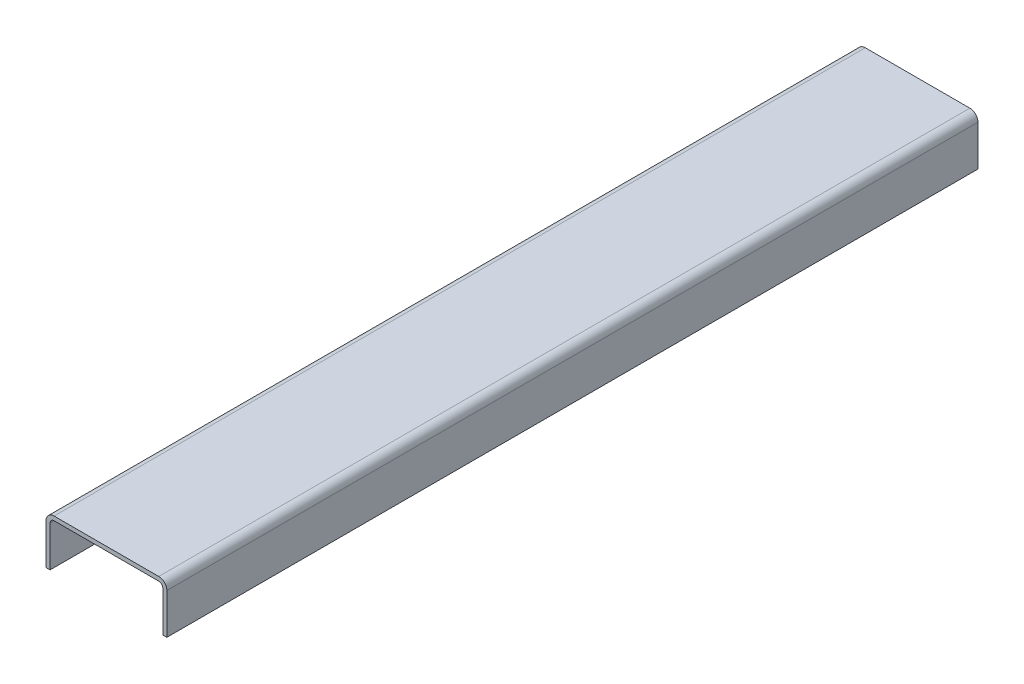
SolidWorks part; units mm, degrees
ref_plane "Face" through (0, 0, 0) normal (0, 0, 1) x (1, 0, 0)
ref_plane "Dessus" through (0, 0, 0) normal (0, 1, 0) x (1, 0, 0)
ref_plane "Droite" through (0, 0, 0) normal (1, 0, 0) x (0, 0, -1)
sketch "Esquisse1" plane through (0, 0, 0) normal (0, 0, 1) x (1, 0, 0)
  line L0 (144, 0) -> (149, 0)
  line L1 (0, 0) -> (5, 0)
  line L2 (0, 0) -> (0, 50)
  line L3 (10, 60) -> (139, 60)
  line L4 (149, 0) -> (149, 50)
  line L6 (5, 0) -> (5, 50)
  line L7 (10, 55) -> (139, 55)
  line L8 (144, 0) -> (144, 50)
  arc A0 (0, 50) -> (10, 60) centre (10, 50) cw
  arc A1 (139, 60) -> (149, 50) centre (139, 50) cw
  arc A2 (5, 50) -> (10, 55) centre (10, 50) cw
  arc A3 (139, 55) -> (144, 50) centre (139, 50) cw
  point P10 (0, 60)
  point P13 (149, 60)
  dimension "D6" = 10
  dimension "D7" = 5
  dimension "D1" = 149
  dimension "D2" = 5
  dimension "D3" = 5
  dimension "D4" = 5
  dimension "D5" = 60
extrude "Base-Extrusion" add sketch "Esquisse1" along normal blind 1000
